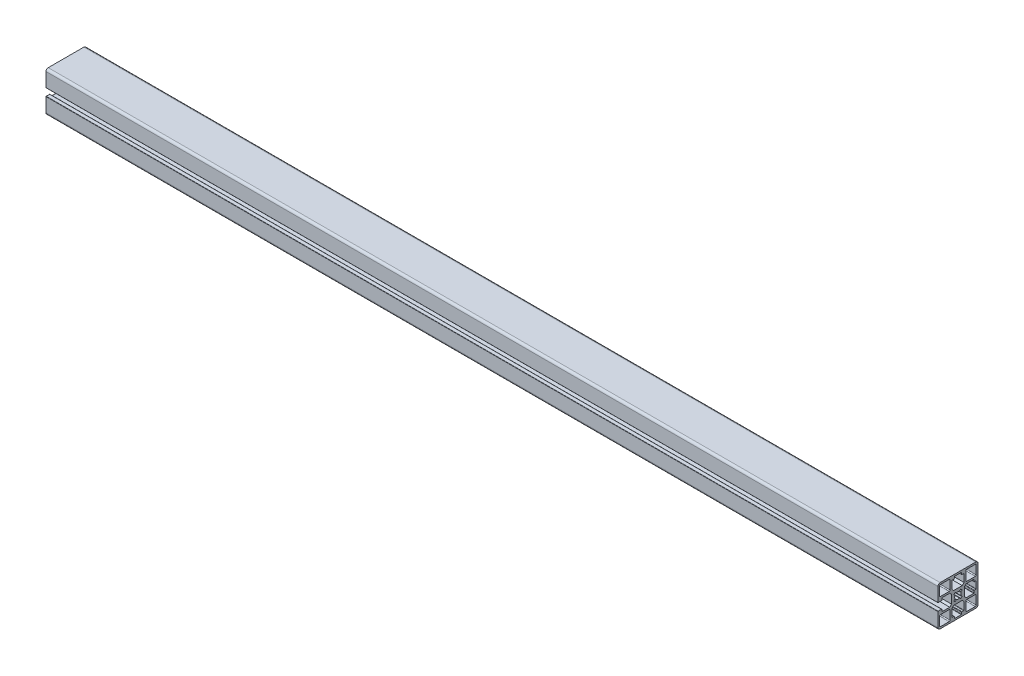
SolidWorks part; units mm, degrees
ref_plane "Front Plane" through (0, 0, 0) normal (0, 0, 1) x (1, 0, 0)
ref_plane "Top Plane" through (0, 0, 0) normal (0, 1, 0) x (1, 0, 0)
ref_plane "Right Plane" through (0, 0, 0) normal (1, 0, 0) x (0, 0, -1)
sketch3d "3DSketch1"
  line L0 (0, 0, 0) -> (1000, 0, 0)
  dimension "D1" = 1000
other "45-sarja 1.0174 45X45 L 3SS VAHV(1)"
ref_plane "Plane1" through (0, 0, 0) normal (1, 0, 0) x (0, 0, 1)
sketch "Model" plane through (0, 0, 0) normal (1, 0, 0) x (0, 0, 1)
  line L0 (6.5, 18) -> (4.6, 18)
  line L1 (4.1, 18.5) -> (4.1, 20.2)
  line L2 (-3.8, -20.5) -> (3.8, -20.5)
  line L3 (9.8, -20.5) -> (19.5, -20.5)
  line L4 (-20.5, -9.8) -> (-20.5, -19.5)
  line L5 (-4.1, 20.2) -> (-4.1, 18.5)
  line L6 (-4.6, 18) -> (-6.5, 18)
  line L7 (-6.8, 17.7) -> (-6.8, 9.2)
  line L8 (-6.8, 9.2) -> (-4.8, 7.2)
  line L9 (-4.8, 7.2) -> (4.8, 7.2)
  line L10 (4.8, 7.2) -> (6.8, 9.2)
  line L11 (6.8, 9.2) -> (6.8, 17.7)
  line L12 (20.5, 9.8) -> (20.5, 19.5)
  line L13 (19.5, 20.5) -> (9.8, 20.5)
  line L14 (8.8, 19.5) -> (8.8, 9.8)
  line L15 (9.8, 8.8) -> (19.5, 8.8)
  line L16 (3.8, 20.5) -> (-3.8, 20.5)
  line L17 (-9.8, 20.5) -> (-19.5, 20.5)
  line L18 (-19.5, 8.8) -> (-9.8, 8.8)
  line L19 (-8.8, 9.8) -> (-8.8, 19.5)
  line L20 (3.3633, 1.9491) -> (4.3841, 2.9698)
  line L21 (4.3841, 3.3941) -> (3.3941, 4.3841)
  line L22 (2.9698, 4.3841) -> (1.9491, 3.3633)
  line L23 (-1.9491, 3.3633) -> (-2.9698, 4.3841)
  line L24 (-3.3941, 4.3841) -> (-4.3841, 3.3941)
  line L25 (-4.3841, 2.9698) -> (-3.3633, 1.9491)
  line L26 (-3.3633, -1.9491) -> (-4.3841, -2.9698)
  line L27 (-4.3841, -3.3941) -> (-3.3941, -4.3841)
  line L28 (-2.9698, -4.3841) -> (-1.9491, -3.3633)
  line L29 (1.9491, -3.3633) -> (2.9698, -4.3841)
  line L30 (3.3941, -4.3841) -> (4.3841, -3.3941)
  line L31 (4.3841, -2.9698) -> (3.3633, -1.9491)
  line L32 (19.5, -8.8) -> (9.8, -8.8)
  line L33 (8.8, -9.8) -> (8.8, -19.5)
  line L34 (-19.5, -20.5) -> (-9.8, -20.5)
  line L35 (20.5, -19.5) -> (20.5, -9.8)
  line L36 (-20.5, 3.8) -> (-20.5, -3.8)
  line L37 (-8.8, -19.5) -> (-8.8, -9.8)
  line L38 (-9.8, -8.8) -> (-19.5, -8.8)
  line L39 (-20.5, 19.5) -> (-20.5, 9.8)
  line L40 (-4.6, -18) -> (-6.5, -18)
  line L41 (-4.1, -20.2) -> (-4.1, -18.5)
  line L43 (-22.5, 20) -> (-22.5, 4.4)
  line L44 (-18.5, -4.1) -> (-20.2, -4.1)
  line L45 (-18, -6.5) -> (-18, -4.6)
  line L46 (-9.2, -6.8) -> (-17.7, -6.8)
  line L47 (-7.2, -4.8) -> (-9.2, -6.8)
  line L48 (-7.2, 4.8) -> (-7.2, -4.8)
  line L49 (-9.2, 6.8) -> (-7.2, 4.8)
  line L50 (-17.7, 6.8) -> (-9.2, 6.8)
  line L51 (-18, 4.6) -> (-18, 6.5)
  line L52 (-20.2, 4.1) -> (-18.5, 4.1)
  line L54 (20, 22.5) -> (-20, 22.5)
  line L55 (22.5, 4.4) -> (22.5, 20)
  line L56 (18.5, 4.1) -> (22.2, 4.1)
  line L57 (18, 6.5) -> (18, 4.6)
  line L58 (9.2, 6.8) -> (17.7, 6.8)
  line L59 (7.2, 4.8) -> (9.2, 6.8)
  line L60 (7.2, -4.8) -> (7.2, 4.8)
  line L61 (9.2, -6.8) -> (7.2, -4.8)
  line L62 (17.7, -6.8) -> (9.2, -6.8)
  line L63 (18, -4.6) -> (18, -6.5)
  line L64 (22.2, -4.1) -> (18.5, -4.1)
  line L65 (22.5, -20) -> (22.5, -4.4)
  line L66 (-20, -22.5) -> (20, -22.5)
  line L67 (4.1, -18.5) -> (4.1, -20.2)
  line L68 (6.5, -18) -> (4.6, -18)
  line L69 (6.8, -9.2) -> (6.8, -17.7)
  line L70 (4.8, -7.2) -> (6.8, -9.2)
  line L71 (-4.8, -7.2) -> (4.8, -7.2)
  line L72 (-6.8, -9.2) -> (-4.8, -7.2)
  line L73 (-6.8, -17.7) -> (-6.8, -9.2)
  line L88 (-22.5, 4.4) -> (-22.5, -20)
  arc A0 (4.1, 18.5) -> (4.6, 18) centre (4.6, 18.5) ccw
  arc A1 (-20.2, 4.1) -> (-20.5, 3.8) centre (-20.2, 3.8) ccw
  arc A2 (-20.2, -4.1) -> (-20.5, -3.8) centre (-20.2, -3.8) cw
  arc A3 (-4.6, 18) -> (-4.1, 18.5) centre (-4.6, 18.5) ccw
  arc A4 (-6.5, 18) -> (-6.8, 17.7) centre (-6.5, 17.7) ccw
  arc A5 (6.8, 17.7) -> (6.5, 18) centre (6.5, 17.7) ccw
  arc A6 (19.5, 8.8) -> (20.5, 9.8) centre (19.5, 9.8) ccw
  arc A7 (20.5, 19.5) -> (19.5, 20.5) centre (19.5, 19.5) ccw
  arc A8 (9.8, 20.5) -> (8.8, 19.5) centre (9.8, 19.5) ccw
  arc A9 (8.8, 9.8) -> (9.8, 8.8) centre (9.8, 9.8) ccw
  arc A10 (-8.8, 19.5) -> (-9.8, 20.5) centre (-9.8, 19.5) ccw
  arc A11 (-19.5, 20.5) -> (-20.5, 19.5) centre (-19.5, 19.5) ccw
  arc A12 (-20.5, 9.8) -> (-19.5, 8.8) centre (-19.5, 9.8) ccw
  arc A13 (-9.8, 8.8) -> (-8.8, 9.8) centre (-9.8, 9.8) ccw
  arc A14 (4.3841, 2.9698) -> (4.3841, 3.3941) centre (4.1719, 3.182) ccw
  arc A15 (3.3941, 4.3841) -> (2.9698, 4.3841) centre (3.182, 4.1719) ccw
  arc A16 (1.6059, 3.3056) -> (1.9491, 3.3633) centre (1.7369, 3.5754) ccw
  arc A17 (1.6059, 3.3056) -> (-1.6059, 3.3056) centre (0, 0) ccw
  arc A18 (-1.9491, 3.3633) -> (-1.6059, 3.3056) centre (-1.7369, 3.5754) ccw
  arc A19 (-2.9698, 4.3841) -> (-3.3941, 4.3841) centre (-3.182, 4.1719) ccw
  arc A20 (-4.3841, 3.3941) -> (-4.3841, 2.9698) centre (-4.1719, 3.182) ccw
  arc A21 (-3.3056, 1.6059) -> (-3.3633, 1.9491) centre (-3.5754, 1.7369) ccw
  arc A22 (-3.3056, 1.6059) -> (-3.3056, -1.6059) centre (0, 0) ccw
  arc A23 (-3.3633, -1.9491) -> (-3.3056, -1.6059) centre (-3.5754, -1.7369) ccw
  arc A24 (-4.3841, -2.9698) -> (-4.3841, -3.3941) centre (-4.1719, -3.182) ccw
  arc A25 (-3.3941, -4.3841) -> (-2.9698, -4.3841) centre (-3.182, -4.1719) ccw
  arc A26 (-1.6059, -3.3056) -> (-1.9491, -3.3633) centre (-1.7369, -3.5754) ccw
  arc A27 (-1.6059, -3.3056) -> (1.6059, -3.3056) centre (0, 0) ccw
  arc A28 (1.9491, -3.3633) -> (1.6059, -3.3056) centre (1.7369, -3.5754) ccw
  arc A29 (2.9698, -4.3841) -> (3.3941, -4.3841) centre (3.182, -4.1719) ccw
  arc A30 (4.3841, -3.3941) -> (4.3841, -2.9698) centre (4.1719, -3.182) ccw
  arc A31 (3.3056, -1.6059) -> (3.3633, -1.9491) centre (3.5754, -1.7369) ccw
  arc A32 (3.3056, -1.6059) -> (3.3056, 1.6059) centre (0, 0) ccw
  arc A33 (3.3633, 1.9491) -> (3.3056, 1.6059) centre (3.5754, 1.7369) ccw
  arc A34 (20.5, -9.8) -> (19.5, -8.8) centre (19.5, -9.8) ccw
  arc A35 (9.8, -8.8) -> (8.8, -9.8) centre (9.8, -9.8) ccw
  arc A36 (8.8, -19.5) -> (9.8, -20.5) centre (9.8, -19.5) ccw
  arc A37 (19.5, -20.5) -> (20.5, -19.5) centre (19.5, -19.5) ccw
  arc A38 (-20.5, -19.5) -> (-19.5, -20.5) centre (-19.5, -19.5) ccw
  arc A39 (-9.8, -20.5) -> (-8.8, -19.5) centre (-9.8, -19.5) ccw
  arc A40 (-8.8, -9.8) -> (-9.8, -8.8) centre (-9.8, -9.8) ccw
  arc A41 (-19.5, -8.8) -> (-20.5, -9.8) centre (-19.5, -9.8) ccw
  arc A42 (-4.1, -18.5) -> (-4.6, -18) centre (-4.6, -18.5) ccw
  arc A44 (-22.5, -20) -> (-20, -22.5) centre (-20, -20) ccw
  arc A46 (-18, -4.6) -> (-18.5, -4.1) centre (-18.5, -4.6) ccw
  arc A47 (-18, -6.5) -> (-17.7, -6.8) centre (-17.7, -6.5) ccw
  arc A48 (-17.7, 6.8) -> (-18, 6.5) centre (-17.7, 6.5) ccw
  arc A49 (-18.5, 4.1) -> (-18, 4.6) centre (-18.5, 4.6) ccw
  arc A51 (-20, 22.5) -> (-22.5, 20) centre (-20, 20) ccw
  arc A52 (22.5, 20) -> (20, 22.5) centre (20, 20) ccw
  arc A53 (22.2, 4.1) -> (22.5, 4.4) centre (22.2, 4.4) ccw
  arc A54 (18, 4.6) -> (18.5, 4.1) centre (18.5, 4.6) ccw
  arc A55 (18, 6.5) -> (17.7, 6.8) centre (17.7, 6.5) ccw
  arc A56 (17.7, -6.8) -> (18, -6.5) centre (17.7, -6.5) ccw
  arc A57 (18.5, -4.1) -> (18, -4.6) centre (18.5, -4.6) ccw
  arc A58 (22.5, -4.4) -> (22.2, -4.1) centre (22.2, -4.4) ccw
  arc A59 (20, -22.5) -> (22.5, -20) centre (20, -20) ccw
  arc A61 (4.6, -18) -> (4.1, -18.5) centre (4.6, -18.5) ccw
  arc A62 (6.5, -18) -> (6.8, -17.7) centre (6.5, -17.7) ccw
  arc A63 (-6.8, -17.7) -> (-6.5, -18) centre (-6.5, -17.7) ccw
  arc A64 (-4.1, -20.2) -> (-3.8, -20.5) centre (-3.8, -20.2) ccw
  arc A65 (4.1, -20.2) -> (3.8, -20.5) centre (3.8, -20.2) cw
  arc A66 (-3.8, 20.5) -> (-4.1, 20.2) centre (-3.8, 20.2) ccw
  arc A67 (3.8, 20.5) -> (4.1, 20.2) centre (3.8, 20.2) cw
  point P118 (-20.5, 4.1)
  point P126 (-22.5, -4.1)
  point P139 (-4.1, -20.5)
  point P181 (4.1, -20.5)
  point P199 (0, 0)
  point P200 (0, 22.5)
  point P201 (-22.5, 0)
  point P202 (22.5, 0)
  point P203 (0, -22.5)
  point P204 (-22.5, 22.5)
  point P205 (22.5, 22.5)
  point P206 (22.5, -22.5)
  point P207 (-22.5, -22.5)
  point P211 (-21, 0)
  point P212 (0, 0)
  dimension "D1" = 0.3
